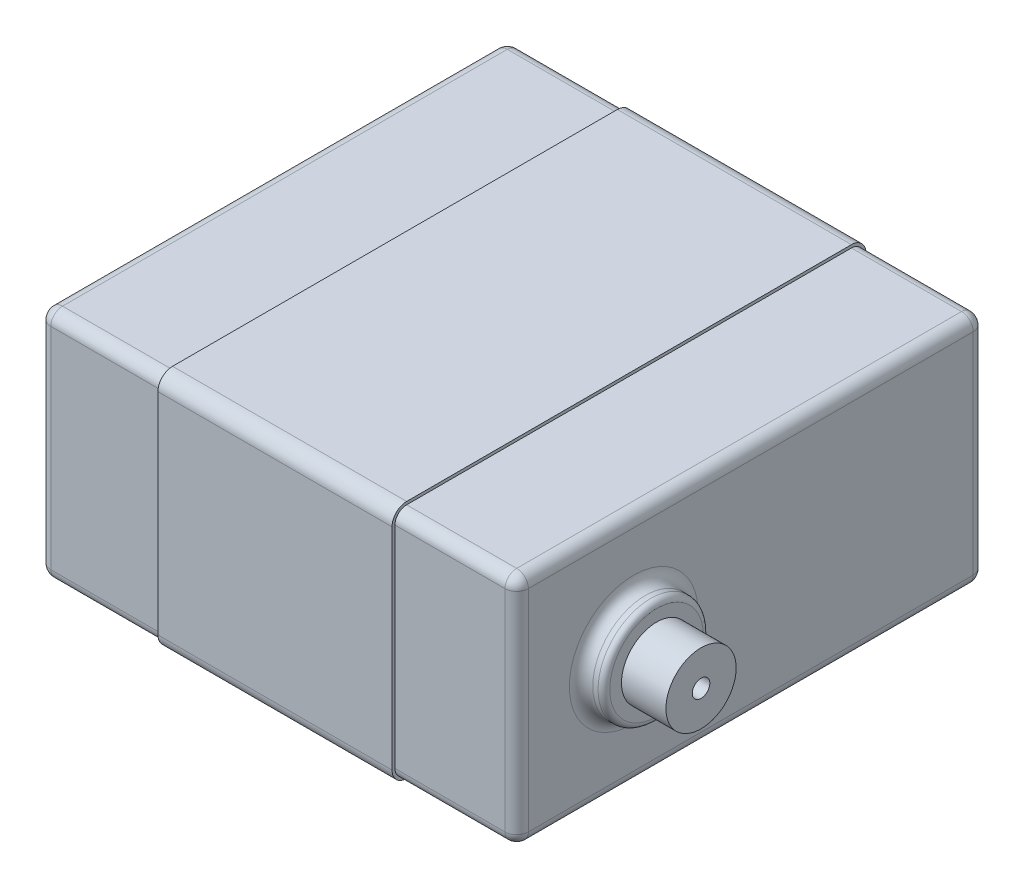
SolidWorks part; units mm, degrees
ref_plane "Front Plane" through (0, 0, 0) normal (0, 0, 1) x (1, 0, 0)
ref_plane "Top Plane" through (0, 0, 0) normal (0, 1, 0) x (1, 0, 0)
ref_plane "Right Plane" through (0, 0, 0) normal (1, 0, 0) x (0, 0, -1)
sketch "Sketch1" plane through (0, 0, 0) normal (0, 0, 1) x (1, 0, 0)
  line L1 (-20.4, -10) -> (20.4, -10)
  line L2 (-20.4, -10) -> (-20.4, 10)
  line L3 (-20.4, 10) -> (20.4, 10)
  line L4 (20.4, -10) -> (20.4, 10)
  line L5 (-20.4, -10) -> (20.4, 10) construction
  line L6 (-20.4, 10) -> (20.4, -10) construction
  point P0 (0, 0)
  dimension "D1" = 40.8
  dimension "D2" = 20
extrude "Boss-Extrude1" add sketch "Sketch1" along normal blind 40
sketch "Sketch2" plane through (20.4, 0, 0) normal (1, 0, 0) x (0, 0, -1)
  line L0 (-40, -10) -> (-40, 10) construction
  line L1 (-40, 10) -> (0, 10) construction
  circle A0 centre (-30, 0) radius 3
  dimension "D1" = 10
  dimension "D2" = 10
  dimension "D3" = 6
extrude "Boss-Extrude2" add sketch "Sketch2" along normal blind 5.75
sketch "Sketch3" plane through (20.4, 0, 0) normal (1, 0, 0) x (0, 0, -1)
  circle A1 centre (-30, 0) radius 4.5
  dimension "D1" = 9
extrude "Boss-Extrude3" add sketch "Sketch3" along normal blind 1.95
sketch "Sketch4" plane through (-20.4, 0, 0) normal (-1, 0, 0) x (0, 0, 1)
  line L0 (40, 10) -> (40, -10) construction
  line L1 (40, 10) -> (0, 10) construction
  circle A0 centre (30, 0) radius 3
  dimension "D2" = 6
  dimension "D3" = 10
  dimension "D1" = 10
extrude "Boss-Extrude4" add sketch "Sketch4" along normal blind 4.75
sketch "Sketch5" plane through (-20.4, 0, 0) normal (-1, 0, 0) x (0, 0, 1)
  circle A0 centre (30, 0) radius 5
  circle A1 centre (30, 0) radius 6
  dimension "D1" = 10
  dimension "D2" = 12
extrude "Boss-Extrude5" add sketch "Sketch5" along normal blind 0.5 draft 30
fillet "Fillet1" radius 1 4 edges at (0, -10, 0) (0, -10, 40) (0, 10, 0) (0, 10, 40)
sketch "Sketch7" plane through (0, 0, 0) normal (1, 0, 0) x (0, 0, -1)
  line L8 (-39, -10.25) -> (-1, -10.25)
  line L9 (0.25, -9) -> (0.25, 9)
  line L10 (-1, 10.25) -> (-39, 10.25)
  line L11 (-40.25, 9) -> (-40.25, -9)
  line L12 (-39, -10.25) -> (-1, -10.25)
  line L13 (0.25, -9) -> (0.25, 9)
  line L14 (-1, 10.25) -> (-39, 10.25)
  line L15 (-40.25, 9) -> (-40.25, -9)
  arc A8 (-1, -10.25) -> (0.25, -9) centre (-1, -9) ccw
  arc A9 (0.25, 9) -> (-1, 10.25) centre (-1, 9) ccw
  arc A10 (-39, 10.25) -> (-40.25, 9) centre (-39, 9) ccw
  arc A11 (-40.25, -9) -> (-39, -10.25) centre (-39, -9) ccw
  arc A12 (-1, -10.25) -> (0.25, -9) centre (-1, -9) ccw
  arc A13 (0.25, 9) -> (-1, 10.25) centre (-1, 9) ccw
  arc A14 (-39, 10.25) -> (-40.25, 9) centre (-39, 9) ccw
  arc A15 (-40.25, -9) -> (-39, -10.25) centre (-39, -9) ccw
  dimension "D1" = 0.25
extrude "Boss-Extrude6" add sketch "Sketch7" along normal mid plane 20
sketch "Sketch8" plane through (26.15, 0, 0) normal (1, 0, 0) x (0, 0, -1)
  circle A0 centre (-30, 0) radius 0.75
  dimension "D1" = 1.5
extrude "Cut-Extrude1" cut sketch "Sketch8" against normal blind 5
mirror "Mirror1" about plane through (0, 0, 0) normal (1, 0, 0) of "Cut-Extrude1"
fillet "Fillet2" radius 1 18 edges at (-20.4, 9.7071, 0.2929) (-20.4, 10, 20) (-20.4, 9.7071, 39.7071) (-20.4, 0, 40) (-20.4, -9.7071, 39.7071) (-20.4, -10, 20) (-20.4, -9.7071, 0.2929) (-20.4, 0, 0) (-20.4, 0, 24) (20.4, -9.7071, 39.7071) (20.4, 0, 40) (20.4, 9.7071, 39.7071) (20.4, 10, 20) (20.4, 9.7071, 0.2929) (20.4, 0, 0) (20.4, -9.7071, 0.2929) (20.4, -10, 20) (20.4, 0, 34.5)
fillet "Fillet3" radius 0.5 1 edges at (22.35, 0, 25.5)
